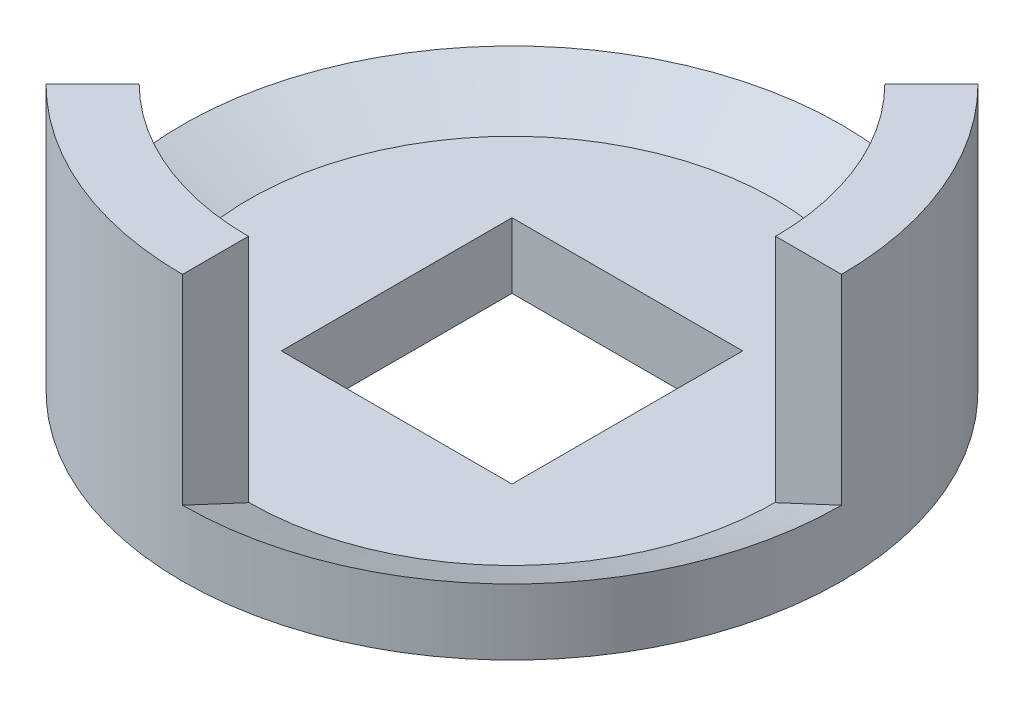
SolidWorks part; units mm, degrees
ref_plane "Face" through (0, 0, 0) normal (0, 0, 1) x (1, 0, 0)
ref_plane "dessus" through (0, 0, 0) normal (0, 1, 0) x (1, 0, 0)
ref_plane "Coté" through (0, 0, 0) normal (1, 0, 0) x (0, 0, -1)
sketch "Esquisse1" plane through (0, 0, 0) normal (0, 0, 1) x (1, 0, 0)
  line L0 (0, 0) -> (12.0338, 0) construction
  line L1 (0, 0) -> (0, 13.2526) construction
  line L2 (0, 0) -> (8, 0)
  line L3 (8, 0) -> (10, 0.9326)
  line L4 (10, 0.9326) -> (10, 2.9326)
  line L5 (10, 2.9326) -> (7.9773, 1.9894)
  line L6 (7.9773, 1.9894) -> (0, 1.9894)
  line L7 (0, 1.9894) -> (0, 0)
  dimension "D1" = 8
  dimension "D2" = 2
  dimension "D3" = 2
  dimension "D4" = 155
  dimension "D5" = 7.9773
revolve "Base-Révolution" add sketch "Esquisse1" angle 360 about L1
sketch "Esquisse2" plane through (0, 1.9894, 0) normal (0, 1, 0) x (-1, 0, 0)
  line L0 (0, 0) -> (-11.3319, 0) construction
  line L1 (0, 0) -> (0, -8.9772) construction
  line L2 (3.5, 3.5) -> (-3.5, 3.5)
  line L3 (3.5, -3.5) -> (-3.5, -3.5)
  line L4 (-3.5, -3.5) -> (-3.5, 3.5)
  line L5 (3.5, -3.5) -> (3.5, 3.5)
  point P4 (3.5, 0)
  point P5 (0, 3.5)
  point P8 (-3.5, 0)
  point P11 (0, -3.5)
  dimension "D1" = 7
  dimension "D2" = 7
extrude "Carré central" cut sketch "Esquisse2" against normal through all
ref_plane "Plan butée" through (0, 1, 0) normal (0, -1, 0) x (1, 0, 0)
extrude "Butées" add sketch "Esquisse3" against normal blind 8
sketch "Esquisse3" plane through (0, 1, 0) normal (0, -1, 0) x (1, 0, 0)
  line L0 (0, 0) -> (10.7432, 0) construction
  line L1 (0, 0) -> (0, 13.9809) construction
  line L2 (0, 0) -> (-9.2531, 9.2531) construction
  line L3 (0, 0) -> (10.567, -10.567) construction
  line L4 (0, 0) -> (10.817, 10.817) construction
  line L5 (0, 0) -> (-8.9588, -8.9588) construction
  line L6 (7.0711, -7.0711) -> (5.6569, -5.6569)
  line L7 (10, 0) -> (8, 0)
  line L8 (-7.0711, 7.0711) -> (-5.6569, 5.6569)
  line L9 (0, 10) -> (0, 8)
  arc A0 (0, 8) -> (-5.6569, 5.6569) centre (0, 0) ccw
  circle A1 centre (0, 0) radius 10 construction
  arc A2 (7.0711, -7.0711) -> (10, 0) centre (0, 0) ccw
  circle A3 centre (0, 0) radius 8 construction
  arc A4 (5.6569, -5.6569) -> (8, 0) centre (0, 0) ccw
  arc A5 (0, 10) -> (-7.0711, 7.0711) centre (0, 0) ccw
  dimension "D1" = 45
  dimension "D2" = 45
